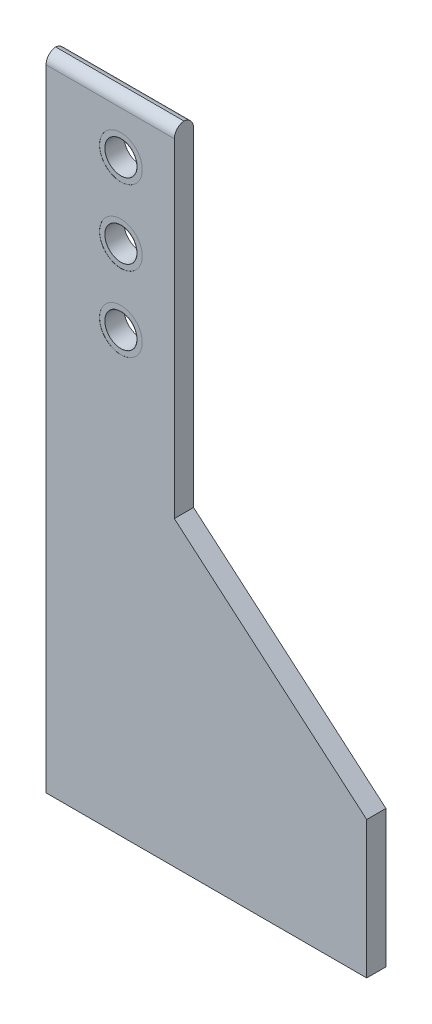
SolidWorks part; units mm, degrees
ref_plane "Front Plane" through (0, 0, 0) normal (0, 0, 1) x (1, 0, 0)
ref_plane "Top Plane" through (0, 0, 0) normal (0, 1, 0) x (1, 0, 0)
ref_plane "Right Plane" through (0, 0, 0) normal (1, 0, 0) x (0, 0, -1)
sketch "Sketch1" plane through (0, 0, 0) normal (0, 0, 1) x (1, 0, 0)
  line L1 (-150, 300) -> (150, 300)
  line L2 (-150, 300) -> (-150, -300)
  line L3 (-150, -300) -> (150, -300)
  line L4 (150, 300) -> (150, -300)
  line L5 (-150, 300) -> (150, -300) construction
  line L6 (-150, -300) -> (150, 300) construction
  point P0 (0, 0)
  dimension "D1" = 300
  dimension "D2" = 600
extrude "Boss-Extrude1" add sketch "Sketch1" along normal blind 18
sketch "Sketch2" plane through (0, 0, 18) normal (0, 0, 1) x (1, 0, 0)
  line L0 (150, 300) -> (-150, 300) construction
  line L1 (-150, 300) -> (-150, -300) construction
  circle A0 centre (-80, 250) radius 15
  circle A1 centre (-80, 180) radius 15
  circle A2 centre (-80, 110) radius 15
  dimension "D1" = 30
  dimension "D4" = 70
  dimension "D2" = 50
  dimension "D3" = 70
  dimension "D5" = 70
  dimension "D6" = 70
  dimension "D7" = 70
extrude "Cut-Extrude1" cut sketch "Sketch2" against normal through all
sketch "Sketch3" plane through (0, 0, 18) normal (0, 0, 1) x (1, 0, 0)
  line L0 (150, 300) -> (150, -171.5953)
  line L1 (150, 300) -> (-150, 300) construction
  line L2 (150, -300) -> (150, 300) construction
  line L4 (150, 300) -> (-30, 300)
  line L5 (-30, 300) -> (-30, -17.7531)
  line L6 (-30, -17.7531) -> (150, -171.5953)
  dimension "D1" = 180
extrude "Cut-Extrude2" cut sketch "Sketch3" against normal blind 60
fillet "Fillet1" radius 10 2 edges at (-90, 300, 0) (-90, 300, 18)
sketch "Sketch4" plane through (0, 0, 18) normal (0, 0, 1) x (1, 0, 0)
  circle A0 centre (-80, 250) radius 15.1
  circle A1 centre (-80, 250) radius 20
  circle A2 centre (-80, 180) radius 15.1
  circle A3 centre (-80, 180) radius 20
  circle A4 centre (-80, 110) radius 15.1
  circle A5 centre (-80, 110) radius 20
  dimension "D1" = 30.2
  dimension "D2" = 40
  dimension "D3" = 30.2
  dimension "D4" = 40
  dimension "D5" = 30.2
  dimension "D6" = 40
extrude "Cut-Extrude3" cut sketch "Sketch4" against normal blind 0.1
ref_plane "Plane1" through (0, 0, 9) normal (0, 0, 1) x (1, 0, 0)
mirror "Mirror1" about plane through (0, 0, 9) normal (0, 0, 1) of "Cut-Extrude3"
